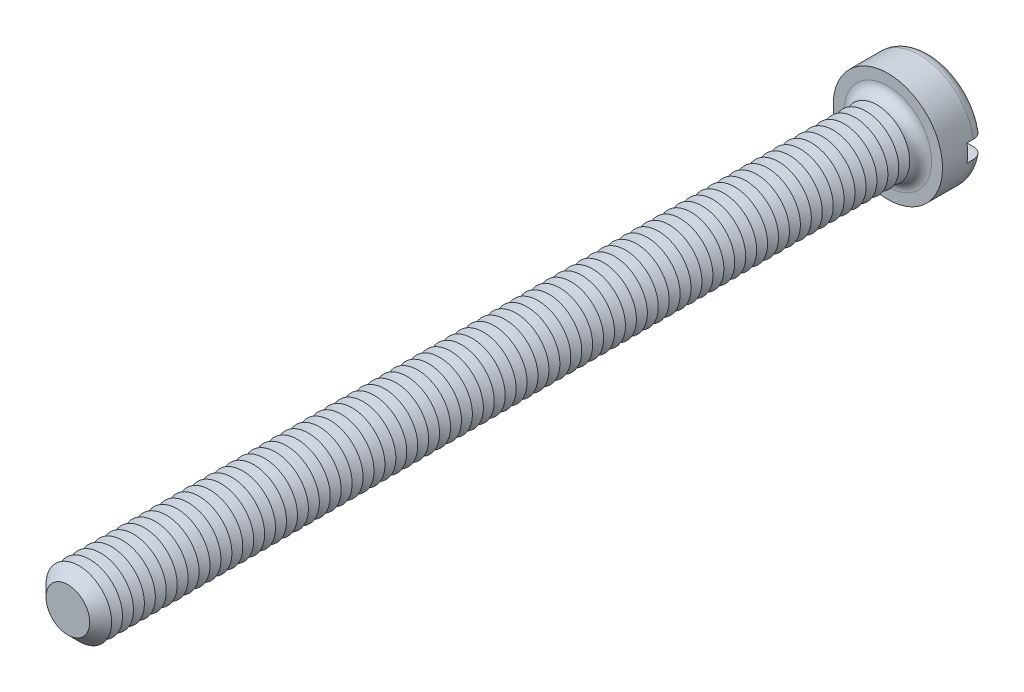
SolidWorks part; units mm, degrees
ref_plane "Front Plane" through (0, 0, 0) normal (0, 0, 1) x (1, 0, 0)
ref_plane "Top Plane" through (0, 0, 0) normal (0, 1, 0) x (1, 0, 0)
ref_plane "Right Plane" through (0, 0, 0) normal (1, 0, 0) x (0, 0, -1)
sketch "Sketch3" plane through (0, 0, 0) normal (0, 0, 1) x (1, 0, 0)
  circle A0 centre (0, 0) radius 5
  dimension "D1" = 10
extrude "Boss-Extrude2" add sketch "Sketch3" against normal blind 3.9
sketch "Sketch4" plane through (0, 0, 0) normal (0, 0, 1) x (1, 0, 0)
  circle A0 centre (0, 0) radius 3
  dimension "D1" = 6
extrude "Boss-Extrude3" add sketch "Sketch4" along normal blind 75
fillet "Fillet1" radius 1 2 edges at (5, 0, -3.9) (3, 0, 0)
chamfer "Chamfer1" distance 1 angle 45 1 edges at (3, 0, 75)
sketch "Sketch5" plane through (0, 0, 0) normal (1, 0, 0) x (0, 0, -1)
  line L0 (1.6944, 0) -> (-7.6738, 0) construction
sketch "Sketch6" plane through (0, 0, 0) normal (1, 0, 0) x (0, 0, -1)
  line L0 (-1, 3) -> (-1.5, 2.134)
  line L1 (-1.5, 2.134) -> (-2, 3)
  line L2 (-1, 3) -> (-74, 3) construction
  line L3 (-2, 3) -> (-1, 3)
  dimension "D1" = 1
revolve "Cut-Revolve1" cut sketch "Sketch6" angle 360 about L0
pattern_linear "LPattern1" count 73 spacing 1 along (0, 0, 1) of "Cut-Revolve1"
sketch "Sketch8" plane through (0, 0, -3.9) normal (0, 0, -1) x (-1, 0, 0)
  line L1 (5, -0.8) -> (-5, -0.8)
  line L2 (5, -0.8) -> (5, 0.8)
  line L3 (5, 0.8) -> (-5, 0.8)
  line L4 (-5, -0.8) -> (-5, 0.8)
  line L5 (5, -0.8) -> (-5, 0.8) construction
  line L6 (5, 0.8) -> (-5, -0.8) construction
  point P0 (0, 0)
  dimension "D1" = 10
  dimension "D2" = 1.6
extrude "Cut-Extrude1" cut sketch "Sketch8" against normal blind 1.6
